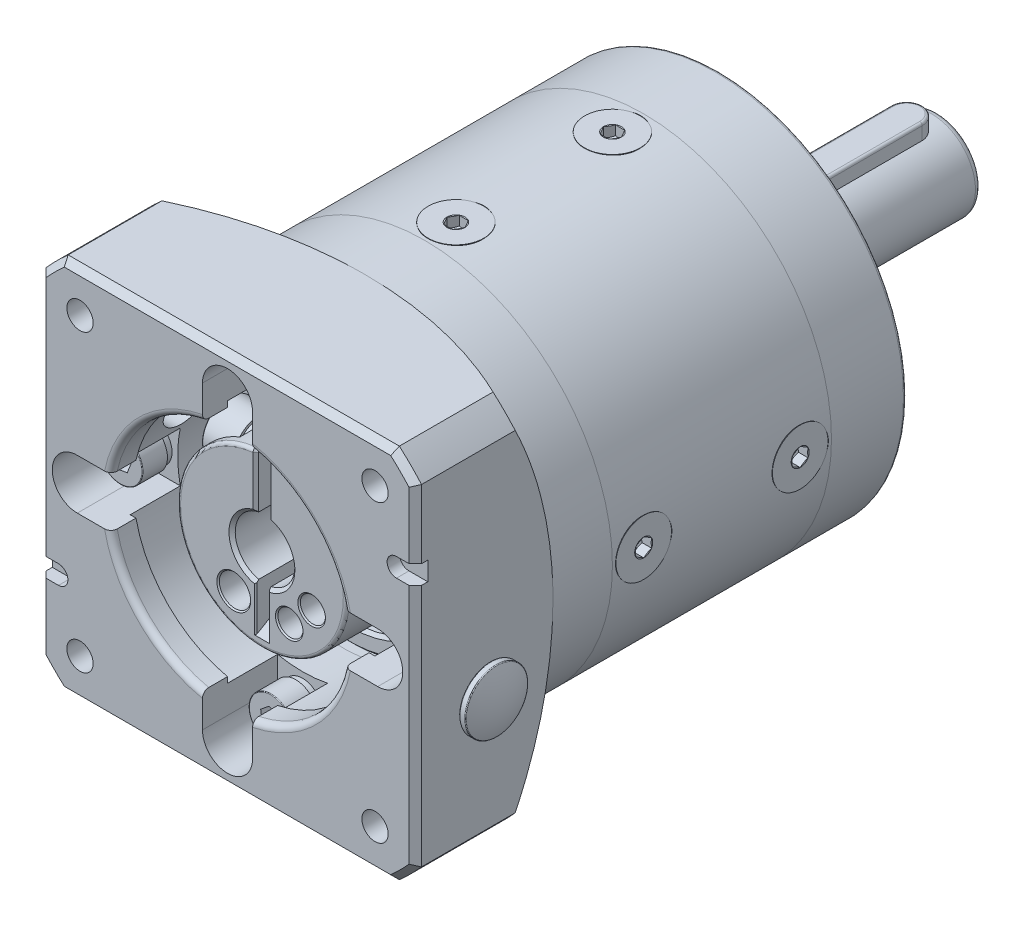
SolidWorks part; units mm, degrees
other "ÇÐ³ý-À Éì1[8]"
other "ÇÐ³ý-À Éì1[2]"
other "ÇÐ³ý-À Éì1[4]"
other "Éî¹µÇòÖá³Ð60000ÐÍ10ÏµÁÐ-4-solid5"
other "Éî¹µÇòÖá³Ð60000ÐÍ10ÏµÁÐ-4-solid2"
other "ÆÕÍ¨Æ½¼üAÐÍ A5-1-solid1"
other "¿×ÓÃµ¯ÐÔµ²È¦AÐÍ-2-solid1"
other "OÐÍÏð½ºÃÜ·âÈ¦-4-solid1"
other "³ÁÍ·ÂÝ¶¤M4¡Á8-6-solid1"
other "PL60.090(ºÚÉ«)-1-solid1"
other "³ÁÍ·ÂÝ¶¤M4¡Á8-7-solid1"
other "³ÁÍ·ÂÝ¶¤M4¡Á8-2-solid1"
other "ËÜÁÏ¿×¶Â-2-solid1"
other "Éî¹µÇòÖá³Ð60000ÐÍ10ÏµÁÐ-3-solid2"
other "ÇÐ³ý-À Éì1[1]"
other "ÄÚÁù½ÇÔ²ÖùÍ·ÂÝ¶¤-M4-3-solid1"
other "OÐÍÏð½ºÃÜ·âÈ¦-3-solid1"
other "Gface2"
other "Éî¹µÇòÖá³Ð60000ÐÍ10ÏµÁÐ-4-solid4"
other "Éî¹µÇòÖá³Ð60000ÐÍ10ÏµÁÐ-4-solid3"
other "ÇÐ³ý-À Éì1[9]"
other "Éî¹µÇòÖá³Ð60000ÐÍ10ÏµÁÐ-3-solid5"
other "ÇÐ³ý-À Éì1[7]"
other "OÐÍÏð½ºÃÜ·âÈ¦-1-solid1"
other "ÇÐ³ý-À Éì1[6]"
other "PL60.070.8-30-38.1-¿Ú47.14-M5£¨ºÚÉ«£©-1-solid1"
other "OÐÍÏð½ºÃÜ·âÈ¦-2-solid1"
other "ÖáÓÃµ¯ÐÔµ²È¦AÐÍ£¨¡Ý10£©-3-solid1"
other "ÇÐ³ý-À Éì1[5]"
other "Éî¹µÇòÖá³Ð60000ÐÍ10ÏµÁÐ-3-solid3"
other "Éî¹µÇòÖá³Ð60000ÐÍ10ÏµÁÐ-3-solid4"
other "ÄÚÁù½ÇÔ²ÖùÍ·ÂÝ¶¤-M4-6-solid1"
other "ÄÚÁù½ÇÔ²ÖùÍ·ÂÝ¶¤-M4-2-solid1"
other "Éî¹µÇòÖá³Ð60000ÐÍ10ÏµÁÐ-4-solid1"
other "12.9-ÄÚÁù½ÇÔ²ÖùÍ·ÂÝ¶¤-M5-3-solid1"
other "³ÁÍ·ÂÝ¶¤M4¡Á8-8-solid1"
other "ËÜÁÏ¿×¶Â-1-solid1"
other "ÇÐ³ý-À Éì1[3]"
other "Éî¹µÇòÖá³Ð60000ÐÍ10ÏµÁÐ-3-solid1"
other "ÄÚÁù½ÇÔ²ÖùÍ·ÂÝ¶¤-M4-4-solid1"
other "Éî¹µÇòÖá³Ð60000ÐÍ19ÏµÁÐ-2-solid1"
ref_plane "Front Plane" through (0, 0, 0) normal (0, 0, 1) x (1, 0, 0)
ref_plane "Top Plane" through (0, 0, 0) normal (0, 1, 0) x (1, 0, 0)
ref_plane "Right Plane" through (0, 0, 0) normal (1, 0, 0) x (0, 0, -1)
imported_body "Imported1"
imported_body "Imported2"
imported_body "Imported3"
imported_body "Imported4"
imported_body "Imported5"
imported_body "Imported6"
imported_body "Imported7"
imported_body "Imported8"
imported_body "Imported9"
imported_body "Imported10"
imported_body "Imported11"
imported_body "Imported12"
imported_body "Imported13"
imported_body "Imported14"
imported_body "Imported15"
imported_body "Imported16"
imported_body "Imported17"
imported_body "Imported18"
imported_body "Imported19"
imported_body "Imported20"
imported_body "Imported21"
imported_body "Imported22"
imported_body "Imported23"
imported_body "Imported24"
imported_body "Imported25"
imported_body "Imported26"
imported_body "Imported27"
imported_body "Imported28"
imported_body "Imported29"
imported_body "Imported30"
imported_body "Imported31"
imported_body "Imported32"
imported_body "Imported33"
imported_body "Imported34"
imported_body "Imported35"
imported_body "Imported36"
imported_body "Imported37"
imported_body "Imported38"
imported_body "Imported39"
imported_body "Imported40"
imported_body "Imported41"
imported_body "Imported42"
imported_body "Imported43"
imported_body "Imported44"
imported_body "Imported45"
ref_plane "Plane1" through (0, -17.3455, 0) normal (0, 1, 0) x (1, 0, 0)
ref_plane "Plane3" through (-0.7497, 0, 0) normal (-1, 0, 0) x (0, 0, 1)
ref_plane "Plane2" through (0, 0, -18.1657) normal (0, 0, -1) x (-1, 0, 0)
sketch "Sketch1" plane through (0, 0, -18.1657) normal (0, 0, -1) x (-1, 0, 0)
  circle A0 centre (-17.6351, 1.0393) radius 2.35
  circle A1 centre (-17.6351, 1.0393) radius 2.1 construction
  dimension "D1" = 0.25
extrude "Boss-Extrude1" add sketch "Sketch1" against normal blind 1.5
pattern_circular "CirPattern1" count 4 over 360 about axis through (-0.7497, -17.3455, 0) along (0, 0, 1) of "Boss-Extrude1"
